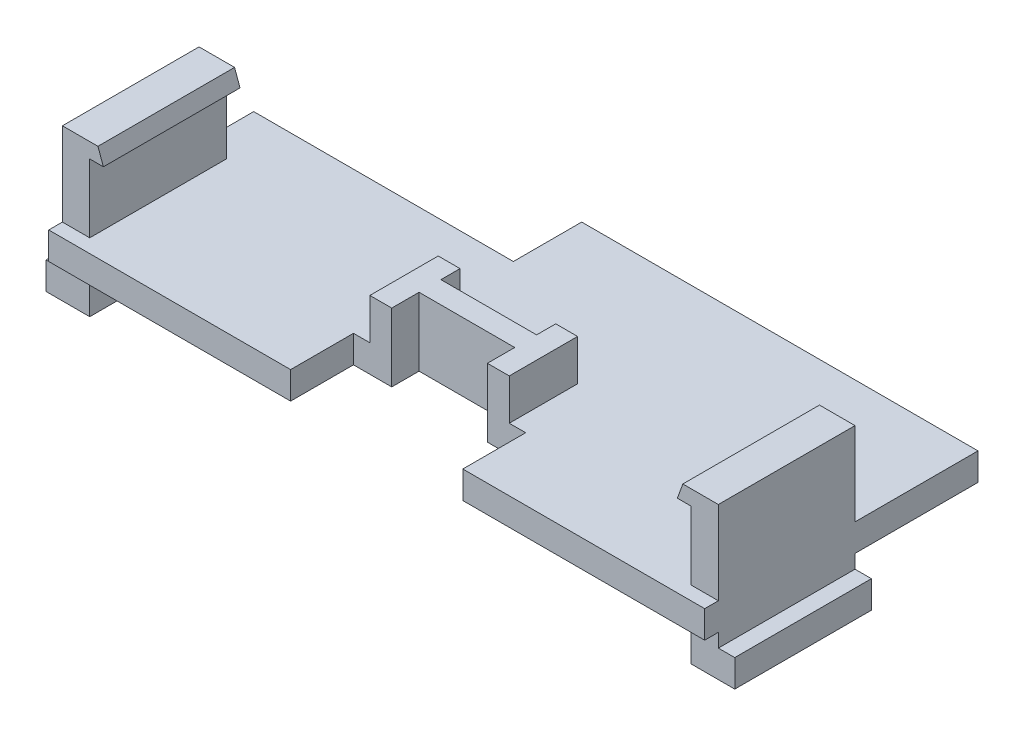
SolidWorks part; units mm, degrees
ref_plane "Front Plane" through (0, 0, 0) normal (0, 0, 1) x (1, 0, 0)
ref_plane "Top Plane" through (0, 0, 0) normal (0, 1, 0) x (1, 0, 0)
ref_plane "Right Plane" through (0, 0, 0) normal (1, 0, 0) x (0, 0, -1)
sketch "Sketch1" plane through (0, 0, 0) normal (0, 1, 0) x (1, 0, 0)
  line L0 (0, -55) -> (0, 55) construction
  line L1 (-12, 9) -> (12, 9)
  line L2 (-12, 9) -> (-12, -1)
  line L3 (-12, -1) -> (12, -1)
  line L4 (12, 9) -> (12, -1)
  line L5 (0, -1) -> (0, 9) construction
  line L6 (-12, 4) -> (12, 4) construction
  line L7 (-55, 0) -> (55, 0) construction
  circle A0 centre (0, 0) radius 2.125 construction
  point P0 (0, 4)
  dimension "D1" = 4.25
  dimension "D2" = 24
  dimension "D3" = 10
  dimension "D4" = 1
extrude "Boss-Extrude1" add sketch "Sketch1" along normal blind 1
sketch "Sketch2" plane through (0, 1, 0) normal (0, 1, 0) x (1, 0, 0)
  line L0 (-3.15, -1) -> (-3.15, 1.3)
  line L1 (-12, 9) -> (-2.5, 9)
  line L2 (-12, 9) -> (-12, 6.5)
  line L3 (-12, 6.5) -> (-2.5, 6.5)
  line L4 (-2.5, 9) -> (-2.5, 6.5)
  line L5 (-12, -1) -> (12, -1) construction
  line L6 (-3.15, 1.3) -> (-1.75, 1.3)
  line L7 (-1.75, 1.3) -> (-1.75, 2.3)
  line L8 (-1.75, 2.3) -> (1.75, 2.3)
  line L10 (0, -3.0529) -> (0, 3.0529) construction
  line L11 (3.15, -1) -> (3.15, 1.3)
  line L12 (3.15, 1.3) -> (1.75, 1.3)
  line L13 (1.75, 1.3) -> (1.75, 2.3)
  line L14 (-3.15, -1) -> (3.15, -1)
  dimension "D1" = 9.5
  dimension "D2" = 2.5
  dimension "D3" = 2.3
  dimension "D4" = 3.3
  dimension "D5" = 3.5
  dimension "D6" = 6.3
extrude "Cut-Extrude1" cut sketch "Sketch2" against normal up to next
sketch "Sketch3" plane through (0, 1, 0) normal (0, 1, 0) x (1, 0, 0)
  line L0 (-2.55, 3.8) -> (-2.55, 1.3)
  line L1 (-2.55, 1.3) -> (-1.75, 1.3)
  line L2 (-1.75, 1.3) -> (-1.75, 2.3)
  line L3 (-1.75, 2.3) -> (1.75, 2.3)
  line L4 (0, -3.0529) -> (0, 3.0529) construction
  line L5 (-2.55, 3.8) -> (-1.75, 3.8)
  line L6 (-1.75, 3.8) -> (-1.75, 3.1)
  line L7 (-1.75, 3.1) -> (1.75, 3.1)
  line L8 (0, 3.1) -> (0, 2.3) construction
  line L11 (-1.75, 2.3) -> (-1.75, 1.3) construction
  line L12 (-1.75, 1.3) -> (-3.15, 1.3) construction
  line L13 (1.75, 2.3) -> (-1.75, 2.3) construction
  line L14 (1.75, 3.8) -> (1.75, 3.1)
  line L15 (2.55, 3.8) -> (1.75, 3.8)
  line L16 (1.75, 1.3) -> (1.75, 2.3)
  line L17 (2.55, 1.3) -> (1.75, 1.3)
  line L18 (2.55, 3.8) -> (2.55, 1.3)
  dimension "D2" = 2.5
  dimension "D3" = 0.8
extrude "Boss-Extrude2" add sketch "Sketch3" along normal blind 1.5
sketch "Sketch4" plane through (0, 0, 0) normal (0, 0, 1) x (1, 0, 0)
  line L0 (12, 1) -> (12, 4.0507)
  line L1 (12, 4.0507) -> (10.7, 4.0507)
  line L2 (10.7, 4.0507) -> (10.5, 3.5)
  line L3 (10.5, 3.5) -> (11, 3.5)
  line L4 (11, 3.5) -> (11, 1)
  line L5 (3.15, 1) -> (12, 1) construction
  line L6 (1.75, 2.5) -> (2.55, 2.5) construction
  line L7 (11, 1) -> (12, 1)
  line L8 (12, 0) -> (12, -0.5)
  line L9 (5.5, 0) -> (-5.5, 0) construction
  line L10 (12, -0.5) -> (12.6, -0.5)
  line L11 (12.6, -0.5) -> (12.6, -1.5)
  line L12 (12.6, -1.5) -> (11, -1.5)
  line L13 (11, -1.5) -> (11, 0)
  line L14 (11, 0) -> (12, 0)
  line L15 (0, -3.0529) -> (0, 3.0529) construction
  line L16 (-11, 0) -> (-12, 0)
  line L17 (-11, -1.5) -> (-11, 0)
  line L18 (-12.6, -1.5) -> (-11, -1.5)
  line L19 (-12.6, -0.5) -> (-12.6, -1.5)
  line L20 (-12, -0.5) -> (-12.6, -0.5)
  line L21 (-12, 0) -> (-12, -0.5)
  line L22 (-11, 1) -> (-12, 1)
  line L23 (-11, 3.5) -> (-11, 1)
  line L24 (-10.5, 3.5) -> (-11, 3.5)
  line L25 (-10.7, 4.0507) -> (-10.5, 3.5)
  line L26 (-12, 4.0507) -> (-10.7, 4.0507)
  line L27 (-12, 1) -> (-12, 4.0507)
  dimension "D1" = 3.0507
  dimension "D2" = 1
  dimension "D3" = 1
  dimension "D4" = 0.5
  dimension "D5" = 1.3
  dimension "D6" = 0.6
  dimension "D7" = 1.5
  dimension "D8" = 1
extrude "Boss-Extrude3" add sketch "Sketch4" along normal blind 0.5 and the other way blind 4.5
